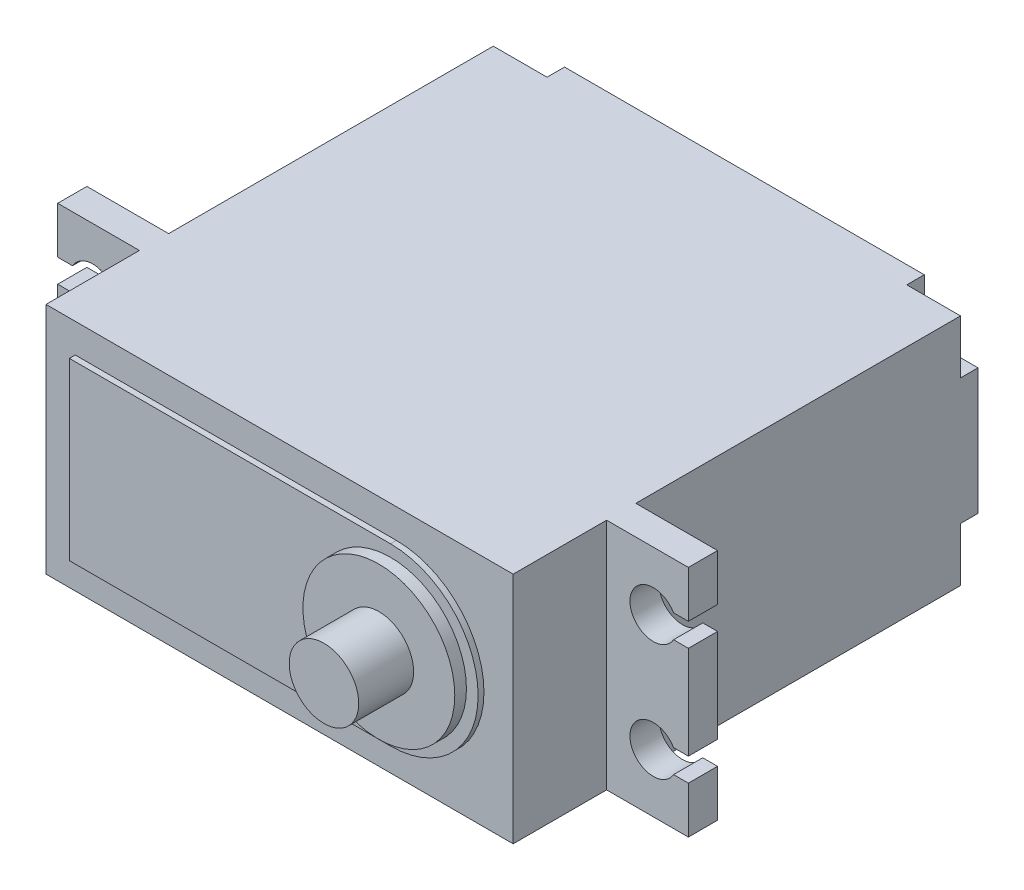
SolidWorks part; units mm, degrees
ref_plane "前视基准面" through (0, 0, 0) normal (0, 0, 1) x (1, 0, 0)
ref_plane "上视基准面" through (0, 0, 0) normal (0, 1, 0) x (1, 0, 0)
ref_plane "右视基准面" through (0, 0, 0) normal (1, 0, 0) x (0, 0, -1)
other "Configuration Table"
sketch "草图1" plane through (0, 0, 0) normal (0, 0, 1) x (1, 0, 0)
  line L1 (-20, -10) -> (20, -10)
  line L2 (-20, -10) -> (-20, 10)
  line L3 (-20, 10) -> (20, 10)
  line L4 (20, -10) -> (20, 10)
  line L5 (-20, -10) -> (20, 10) construction
  line L6 (-20, 10) -> (20, -10) construction
  point P0 (0, 0)
  dimension "D1" = 40
  dimension "D2" = 20
extrude "凸台-拉伸1" add sketch "草图1" along normal blind 39.8
sketch "草图2" plane through (0, 0, 0) normal (0, 0, -1) x (-1, 0, 0)
  line L0 (0, 0) -> (0, 10) construction
  line L1 (-20, 10) -> (20, 10) construction
  line L2 (0, 0) -> (20, 0) construction
  line L3 (20, 10) -> (20, -10) construction
  line L4 (-15.4, 10) -> (-15.4, 8.4)
  line L5 (-18.4, 5.4) -> (-20, 5.4)
  line L6 (-20, -10) -> (-20, 10) construction
  line L7 (18.4, 5.4) -> (20, 5.4)
  line L8 (15.4, 10) -> (15.4, 8.4)
  line L21 (-18.4, -5.4) -> (-20, -5.4)
  line L25 (15.4, -10) -> (15.4, -8.4)
  line L26 (18.4, -5.4) -> (20, -5.4)
  line L27 (-15.4, -10) -> (-15.4, -8.4)
  arc A0 (-18.4, 5.4) -> (-15.4, 8.4) centre (-18.4, 8.4) ccw
  arc A1 (18.4, 5.4) -> (15.4, 8.4) centre (18.4, 8.4) cw
  arc A8 (-18.4, -5.4) -> (-15.4, -8.4) centre (-18.4, -8.4) cw
  arc A12 (18.4, -5.4) -> (15.4, -8.4) centre (18.4, -8.4) ccw
  dimension "D1" = 3
extrude "切除-拉伸1" cut sketch "草图2" against normal blind 1.5 contours L26 A12 L25 M8 M9 | A1 L7 L8 M9 M10 | L5 A0 L4 M10 M7 | A8 L21 L27 M7 M8
sketch "草图3" plane through (-20, 0, 0) normal (-1, 0, 0) x (0, 0, 1)
  line L0 (39.8, 10) -> (1.5, 10) construction
  line L1 (29.3, 10) -> (31.8, 10)
  line L2 (29.3, 10) -> (29.3, -10)
  line L3 (29.3, -10) -> (31.8, -10)
  line L4 (31.8, 10) -> (31.8, -10)
  line L5 (39.8, -10) -> (1.5, -10) construction
  line L6 (39.8, 10) -> (39.8, -10) construction
  dimension "D1" = 8
  dimension "D2" = 2.5
extrude "凸台-拉伸2" add sketch "草图3" along normal blind 7
sketch "草图4" plane through (0, 0, 31.8) normal (0, 0, 1) x (1, 0, 0)
  line L0 (-27, 0) -> (-20, 0) construction
  line L1 (-27, -10) -> (-27, 10) construction
  line L2 (-20, 10) -> (-20, -10) construction
  line L3 (0, 0) -> (0, 10) construction
  line L4 (20, 10) -> (-20, 10) construction
  line L5 (-27.6403, 6) -> (-27.6403, 4)
  line L6 (-25.7321, -6) -> (-27.6403, -6)
  line L8 (-25.7321, -4) -> (-27.6403, -4)
  line L9 (-27.6403, -6) -> (-27.6403, -4)
  line L10 (-25.7321, 4) -> (-27.6403, 4)
  line L11 (-25.7321, 6) -> (-27.6403, 6)
  arc A0 (-25.7321, 4) -> (-25.7321, 6) centre (-24, 5) ccw
  arc A1 (-25.7321, -6) -> (-25.7321, -4) centre (-24, -5) ccw
  dimension "D2" = 4
  dimension "D3" = 10
  dimension "D1" = 48
  dimension "D4" = 2
extrude "切除-拉伸2" cut sketch "草图4" against normal blind 7
mirror "镜向1" about plane through (0, 0, 0) normal (1, 0, 0) of "切除-拉伸2", "凸台-拉伸2"
sketch "草图5" plane through (0, 0, 39.8) normal (0, 0, 1) x (1, 0, 0)
  line L0 (20, 10) -> (-20, 10) construction
  line L1 (10, -7.5) -> (-17.5, -7.5)
  line L3 (10, 7.5) -> (-17.5, 7.5)
  line L4 (-17.5, -7.5) -> (-17.5, 7.5)
  arc A0 (10, -7.5) -> (10, 7.5) centre (10, 0) ccw
  point P0 (0, 0)
  dimension "D1" = 10
  dimension "D2" = 15
extrude "凸台-拉伸3" add sketch "草图5" along normal blind 0.5
sketch "草图6" plane through (0, 0, 40.3) normal (0, 0, 1) x (1, 0, 0)
  line L0 (27, -4) -> (27, 4) construction
  line L1 (20, 10) -> (-20, 10) construction
  circle A0 centre (10, 0) radius 6.5
  point P6 (10, 0)
  dimension "D2" = 13
  dimension "D1" = 17
  dimension "D3" = 10
extrude "凸台-拉伸4" add sketch "草图6" along normal blind 1
sketch "草图7" plane through (0, 0, 41.3) normal (0, 0, 1) x (1, 0, 0)
  circle A0 centre (10, 0) radius 2.975
  point P3 (10, 0)
  dimension "D1" = 5.95
extrude "凸台-拉伸5" add sketch "草图7" along normal blind 5.7 from surface at -1
